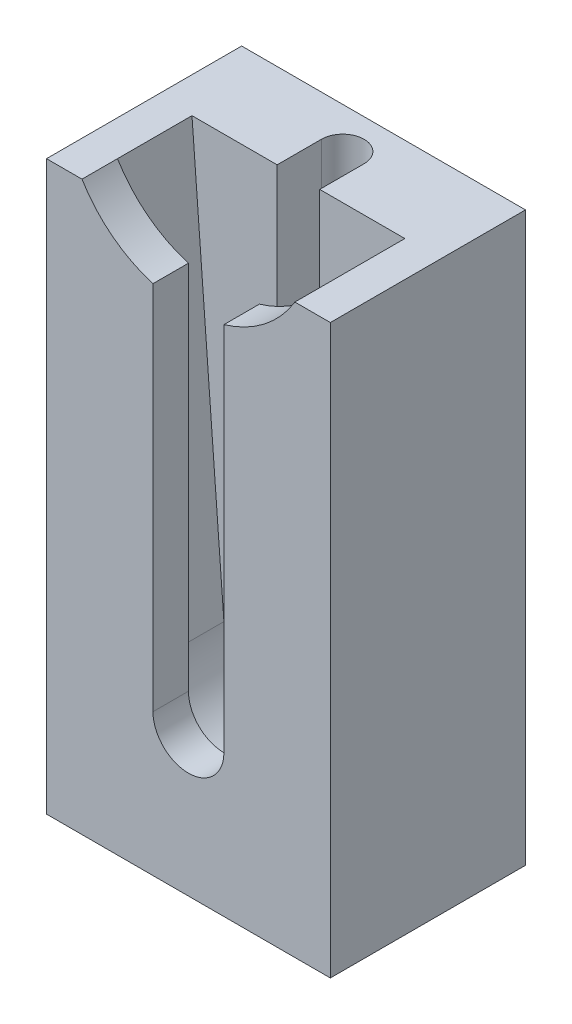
SolidWorks part; units mm, degrees
ref_plane "Přední rovina" through (0, 0, 0) normal (0, 0, 1) x (1, 0, 0)
ref_plane "Horní rovina" through (0, 0, 0) normal (0, 1, 0) x (1, 0, 0)
ref_plane "Pravá rovina" through (0, 0, 0) normal (1, 0, 0) x (0, 0, -1)
sketch "Skica1" plane through (0, 0, 0) normal (0, 0, 1) x (1, 0, 0)
  line L1 (0, 0) -> (8, 0)
  line L2 (0, 0) -> (0, 16)
  line L3 (0, 16) -> (8, 16)
  line L4 (8, 0) -> (8, 16)
  dimension "D1" = 16
  dimension "D2" = 8
extrude "Přidat vysunutím1" add sketch "Skica1" along normal blind 4.5
sketch "Skica2" plane through (0, 0, 4.5) normal (0, 0, 1) x (1, 0, 0)
  line L0 (4, 16) -> (1, 16)
  line L1 (8, 16) -> (0, 16) construction
  line L6 (4, 16) -> (7, 16)
  line L7 (1, 16) -> (1.9, 4.1)
  line L8 (0, 0) -> (8, 0) construction
  line L9 (7, 16) -> (6.1, 4.1)
  line L10 (4, 16) -> (4, -1.8589) construction
  arc A1 (1.9, 4.1) -> (6.1, 4.1) centre (4, 4.1) ccw
  point P6 (4, 2)
  dimension "D1" = 2
  dimension "D2" = 2.1
  dimension "D3" = 3
  dimension "D4" = 3
  dimension "D5" = 0
extrude "Odebrat vysunutím1" cut sketch "Skica2" against normal blind 2.1 and the other way through all
sketch "Skica3" plane through (0, 0, 4.5) normal (0, 0, 1) x (1, 0, 0)
  line L0 (0, 16) -> (8, 16)
  line L1 (8, 16) -> (8, 0)
  line L2 (8, 0) -> (0, 0)
  line L3 (0, 0) -> (0, 16)
extrude "Přidat vysunutím2" add sketch "Skica3" along normal blind 1
sketch "Skica4" plane through (0, 0, 5.5) normal (0, 0, 1) x (1, 0, 0)
  line L0 (4, 16) -> (4, -1.0676) construction
  line L1 (8, 16) -> (0, 16) construction
  line L2 (3, 16) -> (3, 4)
  line L4 (5, 4) -> (5, 16)
  arc A0 (3, 4) -> (5, 4) centre (4, 4) ccw
  point P0 (4, 3)
  dimension "D1" = 0
  dimension "D2" = 2
  dimension "D3" = 13
extrude "Odebrat vysunutím2" cut sketch "Skica4" against normal blind 1 and the other way through all
sketch "Skica5" plane through (0, 16, 0) normal (0, 1, 0) x (1, 0, 0)
  line L3 (7, -2.4) -> (1, -2.4) construction
  line L4 (3.4, -2.4) -> (3.4, -1.15)
  line L6 (4.6, -2.4) -> (4.6, -1.15)
  arc A2 (4.6, -1.15) -> (3.4, -1.15) centre (4, -1.15) ccw
  dimension "D1" = 1.25
  dimension "D2" = 0.6
  dimension "D4" = 1.25
  dimension "D5" = 0
extrude "Odebrat vysunutím8" cut sketch "Skica5" against normal blind 10 and the other way through all
sketch "Skica10" plane through (0, 0, 4.5) normal (0, 0, -1) x (-1, 0, 0)
  circle A0 centre (-4, 17.8028) radius 3.5
extrude "Odebrat vysunutím9" cut sketch "Skica10" against normal blind 1
sketch "Skica11" plane through (0, 0, 2.4) normal (0, 0, 1) x (1, 0, 0)
  circle A0 centre (4, 4) radius 0.75
  dimension "D1" = 1.5
extrude "Odebrat vysunutím10" cut sketch "Skica11" against normal blind 2.5 contours A0
